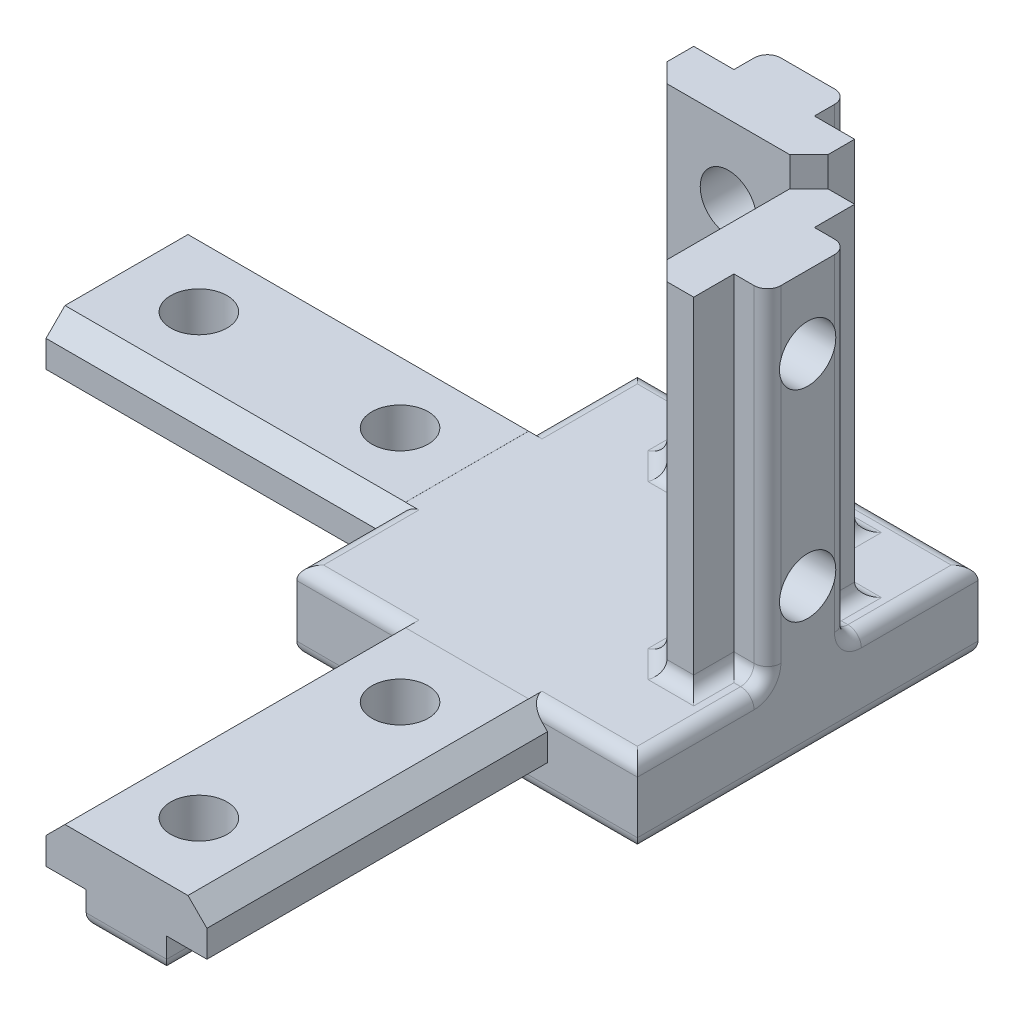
SolidWorks part; units mm, degrees
ref_plane "Front Plane" through (0, 0, 0) normal (0, 0, 1) x (1, 0, 0)
ref_plane "Top Plane" through (0, 0, 0) normal (0, 1, 0) x (1, 0, 0)
ref_plane "Right Plane" through (0, 0, 0) normal (1, 0, 0) x (0, 0, -1)
sketch "Sketch1" plane through (0, 0, 0) normal (0, 1, 0) x (1, 0, 0)
  line L1 (-12.7, 12.7) -> (12.7, 12.7)
  line L2 (-12.7, 12.7) -> (-12.7, -12.7)
  line L3 (-12.7, -12.7) -> (12.7, -12.7)
  line L4 (12.7, 12.7) -> (12.7, -12.7)
  line L5 (-12.7, 12.7) -> (12.7, -12.7) construction
  line L6 (-12.7, -12.7) -> (12.7, 12.7) construction
  point P0 (0, 0)
  dimension "D1" = 25.4
extrude "Boss-Extrude1" add sketch "Sketch1" along normal blind 5.91
sketch "Sketch2" plane through (0, 0, 12.7) normal (0, 0, 1) x (1, 0, 0)
  line L0 (-3, 0) -> (3, 0)
  line L1 (-12.7, 0) -> (12.7, 0) construction
  line L2 (3, 0) -> (3, 2.5)
  line L3 (3, 2.5) -> (6, 2.5)
  line L4 (6, 2.5) -> (6, 4.5)
  line L5 (6, 4.5) -> (4.5858, 5.9142)
  line L6 (4.5858, 5.9142) -> (-4.5858, 5.9142)
  line L7 (0, 0) -> (0, 6.6193) construction
  line L8 (-6, 4.5) -> (-4.5858, 5.9142)
  line L9 (-6, 2.5) -> (-6, 4.5)
  line L10 (-3, 2.5) -> (-6, 2.5)
  line L11 (-3, 0) -> (-3, 2.5)
  point P14 (0, 5.9142)
  point P18 (0, 0)
  dimension "D1" = 6
  dimension "D2" = 12
  dimension "D3" = 135
  dimension "D4" = 2.5
  dimension "D5" = 2
extrude "Boss-Extrude2" add sketch "Sketch2" along normal blind 25.4
sketch "Sketch3" plane through (-12.7, 0, 0) normal (-1, 0, 0) x (0, 0, 1)
  line L0 (-3, 0) -> (3, 0)
  line L1 (3, 0) -> (3, 2.5)
  line L2 (3, 2.5) -> (6, 2.5)
  line L3 (6, 2.5) -> (6, 4.5)
  line L4 (6, 4.5) -> (4.5858, 5.9142)
  line L5 (4.5858, 5.9142) -> (-4.5858, 5.9142)
  line L6 (0, 0) -> (0, 6.6193) construction
  line L7 (-6, 4.5) -> (-4.5858, 5.9142)
  line L8 (-6, 2.5) -> (-6, 4.5)
  line L9 (-3, 2.5) -> (-6, 2.5)
  line L10 (-3, 0) -> (-3, 2.5)
  point P9 (0, 5.9142)
  point P13 (0, 0)
  dimension "D1" = 6
  dimension "D2" = 12
  dimension "D3" = 2.5
  dimension "D4" = 2
  dimension "D5" = 135
extrude "Boss-Extrude3" add sketch "Sketch3" along normal blind 25.4
sketch "Sketch5" plane through (0, 5.91, 0) normal (0, 1, 0) x (1, 0, 0)
  line L0 (3, 12.7) -> (-3, 12.7)
  line L1 (-3, 12.7) -> (-3, 10.2)
  line L2 (-3, 10.2) -> (-6, 10.2)
  line L3 (-6, 10.2) -> (-6, 8.2)
  line L4 (-6, 8.2) -> (-4.5858, 6.7858)
  line L5 (-4.5858, 6.7858) -> (4.5858, 6.7858)
  line L6 (0, 3.4686) -> (0, -3.1261) construction
  line L7 (6, 8.2) -> (4.5858, 6.7858)
  line L8 (6, 10.2) -> (6, 8.2)
  line L9 (3, 10.2) -> (6, 10.2)
  line L10 (3, 12.7) -> (3, 10.2)
  line L11 (12.7, 12.7) -> (-12.7, 12.7) construction
  line L12 (12.7, -3) -> (12.7, 3)
  line L13 (12.7, 3) -> (10.2, 3)
  line L14 (10.2, 3) -> (10.2, 6)
  line L15 (10.2, 6) -> (8.2, 6)
  line L16 (8.2, 6) -> (6.7858, 4.5858)
  line L17 (6.7858, 4.5858) -> (6.7858, -4.5858)
  line L18 (6.7858, 0) -> (12.7, 0) construction
  line L19 (8.2, -6) -> (6.7858, -4.5858)
  line L20 (10.2, -6) -> (8.2, -6)
  line L21 (10.2, -3) -> (10.2, -6)
  line L22 (12.7, -3) -> (10.2, -3)
  line L23 (12.7, -12.7) -> (12.7, 12.7) construction
  point P9 (0, 6.7858)
  point P13 (0, 12.7)
  point P27 (6.7858, 0)
  point P31 (12.7, 0)
  dimension "D1" = 6
  dimension "D2" = 12
  dimension "D3" = 2.5
  dimension "D4" = 2
  dimension "D5" = 135
  dimension "D6" = 2.5
  dimension "D7" = 6
  dimension "D8" = 12
  dimension "D9" = 2
  dimension "D10" = 135
  dimension "D11" = 135
extrude "Boss-Extrude4" add sketch "Sketch5" along normal blind 25.4
fillet "Fillet2" radius 1 42 edges at (3, 18.61, -12.7) (12.7, 18.61, -3) (12.7, 18.61, 3) (-3, 18.61, -12.7) (-6, 5.91, -9.2) (-5.2929, 5.91, -7.4929) (0, 5.91, -6.7858) (5.2929, 5.91, -7.4929) (6, 5.91, -9.2) (4.5, 5.91, -10.2) (3, 5.91, -11.45) (7.85, 5.91, -12.7) (12.7, 5.91, -7.85) (11.45, 5.91, -3) (10.2, 5.91, -4.5) (9.2, 5.91, -6) (7.4929, 5.91, -5.2929) (6.7858, 5.91, 0) (7.4929, 5.91, 5.2929) (9.2, 5.91, 6) (10.2, 5.91, 4.5) (11.45, 5.91, 3) (12.7, 5.91, 7.85) (8.645, 5.91, 12.7) (-8.645, 5.91, 12.7) (-12.7, 5.91, 8.645) (-12.7, 5.91, -8.645) (-7.85, 5.91, -12.7) (-3, 5.91, -11.45) (-4.5, 5.91, -10.2) (0, 0, -12.7) (-12.7, 0, -7.85) (-25.4, 0, -3) (-38.1, 0, 0) (-25.4, 0, 3) (-12.7, 0, 7.85) (-7.85, 0, 12.7) (-3, 0, 25.4) (0, 0, 38.1) (3, 0, 25.4) (7.85, 0, 12.7) (12.7, 0, 0)
hole_wizard "M5x0.8 Tapped Hole2" positions "Sketch8" profile "Sketch9" tap size "M5x0.8" standard "ANSI Metric"
sketch "Sketch8" plane through (0, 0, 0) normal (0, -1, 0) x (-1, 0, 0)
  line L0 (12.7, 6) -> (12.7, 3) construction
  line L1 (6, -12.7) -> (3, -12.7) construction
  point P0 (0, -17.7)
  point P2 (0, -32.7)
  point P4 (17.7, 0)
  point P6 (32.7, 0)
  point P17 (-10.3114, -30.8057)
  point P20 (0, 0)
  point P22 (0, 0)
  dimension "D1" = 5
  dimension "D2" = 15
  dimension "D3" = 5
  dimension "D4" = 15
sketch "Sketch9" plane through (0, 0, 17.7) normal (1, 0, 0) x (0, 0, -1)
  line L0 (0, 0) -> (0, 31.31)
  line L1 (0, 31.31) -> (2.1, 31.31)
  line L2 (2.1, 31.31) -> (2.1, 0)
  line L5 (2.1, 0) -> (0, 0)
  line L11 (0, -6.35) -> (0, 107.95) construction
  dimension "Thru Tap Drill Dia." = 4.2
  dimension "Thru Tap Drill Depth" = 31.31
hole_wizard "M5x0.8 Tapped Hole3" positions "Sketch10" profile "Sketch11" tap size "M5x0.8" standard "ANSI Metric"
sketch "Sketch10" plane through (12.7, 0, 0) normal (1, 0, 0) x (0, 0, -1)
  line L0 (-4, 5.91) -> (-7, 5.91) construction
  point P0 (0, 10.91)
  point P2 (0, 25.91)
  point P7 (0, 0)
  dimension "D1" = 5
  dimension "D2" = 15
sketch "Sketch11" plane through (12.7, 10.91, 0) normal (0, 1, 0) x (0, 0, -1)
  line L0 (0, 0) -> (0, 50.8)
  line L1 (0, 50.8) -> (2.1, 50.8)
  line L2 (2.1, 50.8) -> (2.1, 0)
  line L5 (2.1, 0) -> (0, 0)
  line L11 (0, -6.35) -> (0, 107.95) construction
  dimension "Thru Tap Drill Dia." = 4.2
  dimension "Thru Tap Drill Depth" = 50.8
hole_wizard "M5x0.8 Tapped Hole4" positions "Sketch12" profile "Sketch13" tap size "M5x0.8" standard "ANSI Metric"
sketch "Sketch12" plane through (0, 0, -12.7) normal (0, 0, -1) x (-1, 0, 0)
  line L0 (-4, 5.91) -> (-7, 5.91) construction
  point P0 (0, 25.91)
  point P2 (0, 10.91)
  point P7 (0, 0)
  dimension "D1" = 5
  dimension "D2" = 15
sketch "Sketch13" plane through (0, 25.91, -12.7) normal (1, 0, 0) x (0, 1, 0)
  line L0 (0, 0) -> (0, 50.8)
  line L1 (0, 50.8) -> (2.1, 50.8)
  line L2 (2.1, 50.8) -> (2.1, 0)
  line L5 (2.1, 0) -> (0, 0)
  line L11 (0, -6.35) -> (0, 107.95) construction
  dimension "Thru Tap Drill Dia." = 4.2
  dimension "Thru Tap Drill Depth" = 50.8
equation "\"Insert Lengths\"= 1in"
equation "\"D1@Boss-Extrude2\"=\"Insert Lengths\""
equation "\"D1@Boss-Extrude4\"=\"Insert Lengths\""
